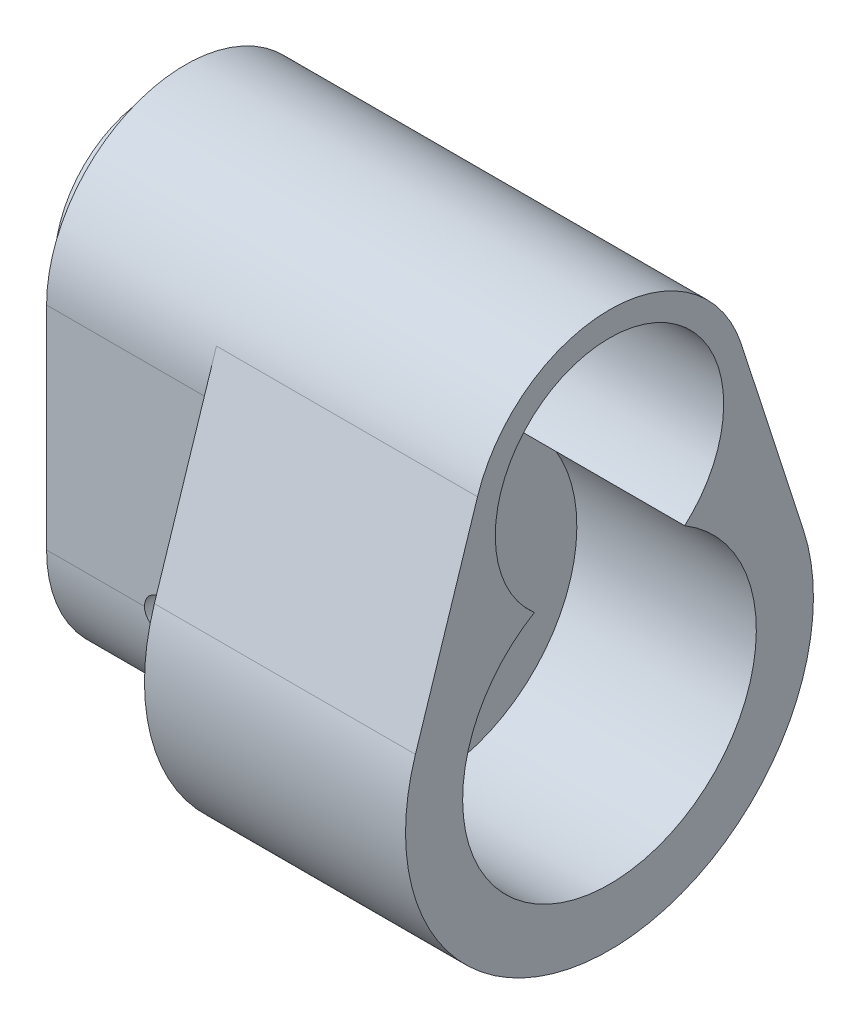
SolidWorks part; units mm, degrees
ref_plane "前视基准面" through (0, 0, 0) normal (0, 0, 1) x (1, 0, 0)
ref_plane "上视基准面" through (0, 0, 0) normal (0, 1, 0) x (1, 0, 0)
ref_plane "右视基准面" through (0, 0, 0) normal (1, 0, 0) x (0, 0, -1)
sketch "草图2" plane through (0, 0, 0) normal (1, 0, 0) x (0, 0, -1)
  line L0 (-16.1753, 31.2308) -> (-23.7871, 7.6923)
  line L2 (16.1753, 31.2308) -> (23.7871, 7.6923)
  arc A0 (16.1753, 31.2308) -> (-16.1753, 31.2308) centre (0, 26) ccw
  arc A3 (-23.7871, 7.6923) -> (23.7871, 7.6923) centre (0, 0) ccw
extrude "拉伸2" add sketch "草图2" along normal blind 32
sketch "草图3" plane through (0, 0, 0) normal (-1, 0, 0) x (0, 0, 1)
  line L0 (17, 26) -> (17, 0)
  line L1 (-17, 26) -> (-17, 0)
  arc A0 (17, 26) -> (-17, 26) centre (0, 26) ccw
  arc A1 (-17, 0) -> (17, 0) centre (0, 0) ccw
extrude "拉伸3" add sketch "草图3" along normal blind 20
sketch "草图4" plane through (-20, 0, 0) normal (-1, 0, 0) x (0, 0, 1)
  circle A0 centre (0, 26) radius 10
  circle A1 centre (0, 0) radius 8
extrude "切除-拉伸1" cut sketch "草图4" against normal through all
sketch "草图5" plane through (32, 0, 0) normal (1, 0, 0) x (0, 0, -1)
  arc A0 (9.2163, 15.4615) -> (-9.2163, 15.4615) centre (0, 26) ccw
  arc A1 (-9.2163, 15.4615) -> (9.2163, 15.4615) centre (0, 0) ccw
extrude "切除-拉伸3" cut sketch "草图5" against normal blind 22
sketch "草图6" plane through (-20, 0, 0) normal (-1, 0, 0) x (0, 0, 1)
  circle A0 centre (0, 26) radius 12
  circle A1 centre (0, 26) radius 10
extrude "拉伸4" add sketch "草图6" along normal blind 4
sketch "草图7" plane through (0, 0, 17) normal (0, 0, 1) x (1, 0, 0)
  line L0 (-20, 0) -> (0, 0) construction
  line L1 (-20, 0) -> (-20, 26) construction
  circle A0 centre (-6, 0) radius 2
  dimension "D2" = 4
  dimension "D1" = 14
extrude "切除-拉伸4" cut sketch "草图7" against normal through all
